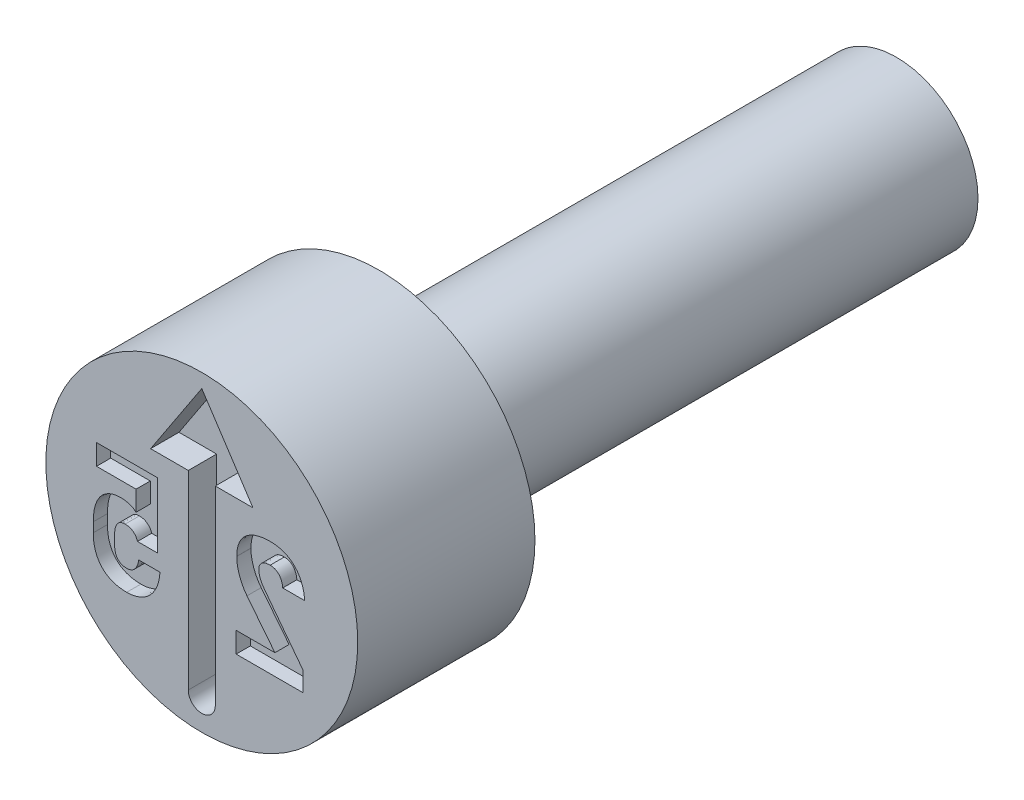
SolidWorks part; units mm, degrees
ref_plane "Front Plane" through (0, 0, 0) normal (0, 0, 1) x (1, 0, 0)
ref_plane "Top Plane" through (0, 0, 0) normal (0, 1, 0) x (1, 0, 0)
ref_plane "Right Plane" through (0, 0, 0) normal (1, 0, 0) x (0, 0, -1)
sketch "Sketch2" plane through (0, 0, 0) normal (1, 0, 0) x (0, 0, -1)
  line L0 (0.4039, 0) -> (50000.4039, 0) construction
  line L6 (0, 2.2) -> (0, 0)
  line L7 (2.5, 2.2) -> (0, 2.2)
  line L8 (2.5, 1.15) -> (2.5, 2.2)
  line L9 (9.8, 1.15) -> (2.5, 1.15)
  line L10 (9.8, 0) -> (9.8, 1.15)
  line L11 (0, 0) -> (9.8, 0)
  dimension "D1" = 4.4
  dimension "D2" = 2.3
  dimension "D3" = 9.8
  dimension "D4" = 2.5
revolve "Revolve1" add sketch "Sketch2" angle 360 about L0
sketch "Sketch3" plane through (0, 0, 0) normal (0, 0, 1) x (1, 0, 0)
  line L0 (0, 0) -> (0, 100000) construction
  line L1 (0.1905, 0.9064) -> (0.1905, -1.7762)
  line L2 (0.7219, 0.9064) -> (0.1905, 0.9064)
  line L3 (0, 2.0021) -> (0.7219, 0.9064)
  line L15 (0, 2.0021) -> (-0.7219, 0.9064)
  line L16 (-0.7219, 0.9064) -> (-0.1905, 0.9064)
  line L17 (-0.1905, 0.9064) -> (-0.1905, -1.7762)
  arc A2 (-0.1905, -1.7762) -> (0.1905, -1.7762) centre (0, -1.7762) ccw
extrude "Cut-Extrude4" cut sketch "Sketch3" against normal blind 0.4
sketch "Sketch4" plane through (0, 0, 0) normal (0, 0, 1) x (1, 0, 0)
  text T0 "2  5" font "Bahnschrift" height 1.6
  dimension "D1" = 1
  dimension "D2" = 1.55
extrude "Cut-Extrude5" cut sketch "Sketch4" against normal blind 0.2
